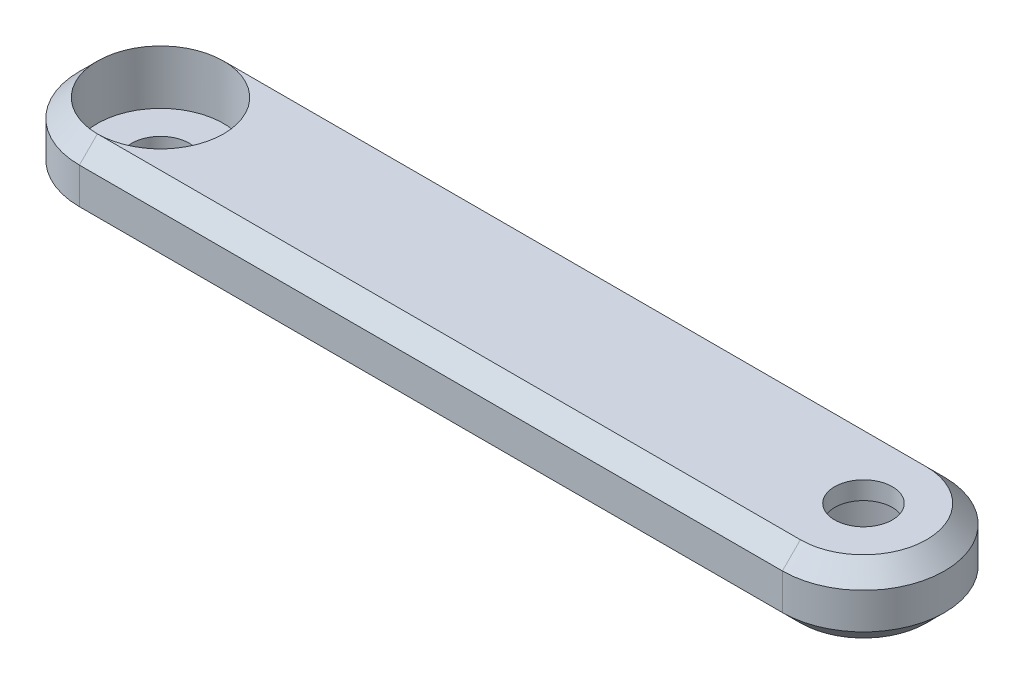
SolidWorks part; units mm, degrees
ref_plane "Front Plane" through (0, 0, 0) normal (0, 0, 1) x (1, 0, 0)
ref_plane "Top Plane" through (0, 0, 0) normal (0, 1, 0) x (1, 0, 0)
ref_plane "Right Plane" through (0, 0, 0) normal (1, 0, 0) x (0, 0, -1)
sketch "草图1" plane through (0, 0, 0) normal (0, 1, 0) x (1, 0, 0)
  line L1 (-15.6633, 5.8053) -> (11.3367, 5.8053)
  line L3 (-15.6633, -3.1947) -> (11.3367, -3.1947)
  line L4 (11.3367, 5.8053) -> (23.3367, 5.8053)
  line L6 (11.3367, -3.1947) -> (23.3367, -3.1947)
  arc A1 (-15.6633, 5.8053) -> (-15.6633, -3.1947) centre (-15.6633, 1.3053) ccw
  arc A2 (23.3367, -3.1947) -> (23.3367, 5.8053) centre (23.3367, 1.3053) ccw
  dimension "D3" = 12
  dimension "D1" = 27
  dimension "D2" = 9
extrude "凸台-拉伸1" add sketch "草图1" along normal blind 4
sketch "草图2" plane through (0, 4, 0) normal (0, 1, 0) x (1, 0, 0)
  line L0 (3.8367, 5.8053) -> (3.8367, -3.1947)
  line L1 (23.3367, 5.8053) -> (-15.6633, 5.8053) construction
  line L2 (-15.6633, -3.1947) -> (23.3367, -3.1947) construction
  circle A0 centre (-15.6633, 1.3053) radius 1.6
  circle A2 centre (23.3367, 1.3053) radius 1.6
extrude "切除-拉伸4" cut sketch "草图2" against normal blind 10 contours A2 | A0
chamfer "倒角1" distance 1 angle 45 8 edges at (3.8367, 4, 3.1947) (3.8367, 4, -5.8053) (-20.1633, 4, -1.3053) (-20.1633, 0, -1.3053) (3.8367, 0, 3.1947) (3.8367, 0, -5.8053) (27.8367, 4, -1.3053) (27.8367, 0, -1.3053)
sketch "草图5" plane through (0, 0, 0) normal (0, -1, 0) x (1, 0, 0)
  circle A0 centre (23.3367, -1.3053) radius 1.6
  circle A1 centre (23.3367, -1.3053) radius 2.25
extrude "凸台-拉伸2" add sketch "草图5" against normal up to surface (4 mm away)
sketch "草图7" plane through (0, 0, 0) normal (0, -1, 0) x (1, 0, 0)
  circle A0 centre (23.3367, -1.3053) radius 3.5
extrude "切除-拉伸6" cut sketch "草图7" against normal blind 3
sketch "草图8" plane through (0, 4, 0) normal (0, 1, 0) x (1, 0, 0)
  circle A0 centre (-15.6633, 1.3053) radius 3.5
extrude "切除-拉伸7" cut sketch "草图8" against normal blind 3
